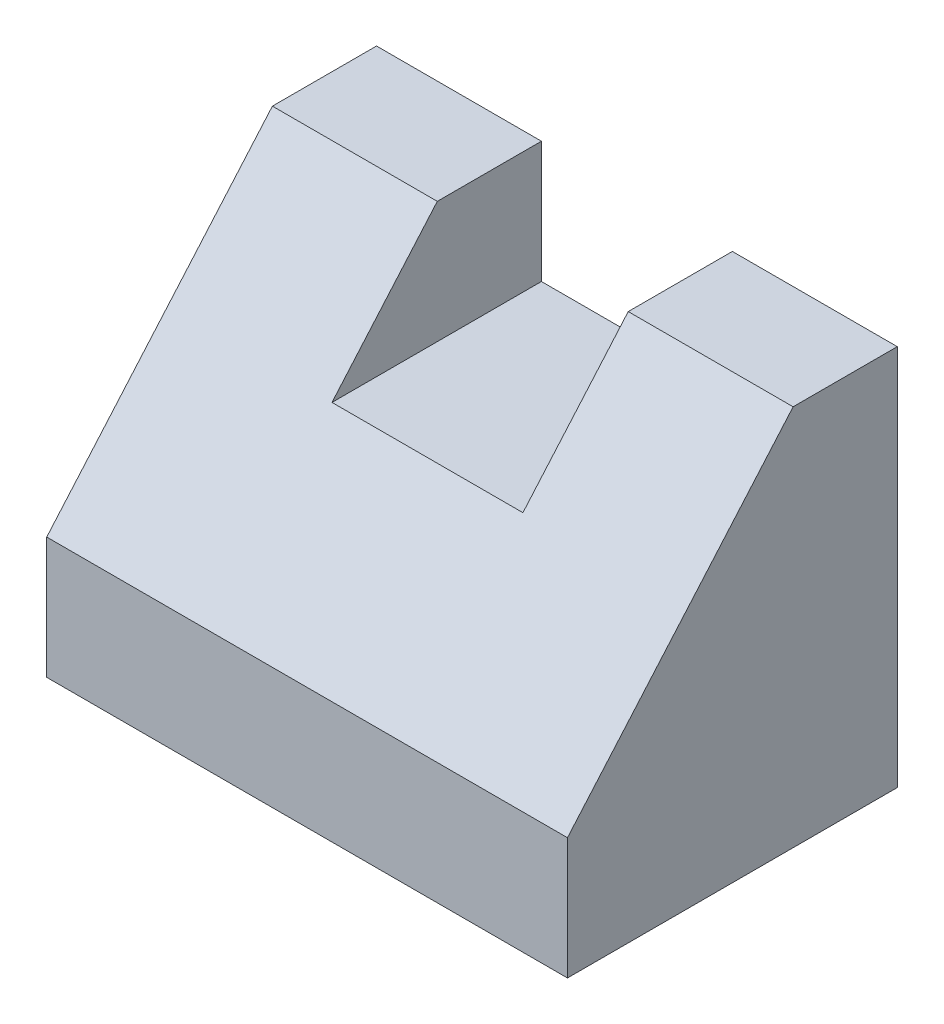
SolidWorks part; units mm, degrees
ref_plane "前视基准面" through (0, 0, 0) normal (0, 0, 1) x (1, 0, 0)
ref_plane "上视基准面" through (0, 0, 0) normal (0, 1, 0) x (1, 0, 0)
ref_plane "右视基准面" through (0, 0, 0) normal (1, 0, 0) x (0, 0, -1)
sketch "草图1" plane through (0, 0, 0) normal (1, 0, 0) x (0, 0, -1)
  line L0 (0, 0) -> (0, -22)
  line L1 (0, -22) -> (-19, -22)
  line L2 (-19, -22) -> (-19, -15)
  line L3 (-19, -15) -> (-6, 0)
  line L4 (-6, 0) -> (0, 0)
  dimension "D1" = 22
  dimension "D2" = 19
  dimension "D3" = 7
  dimension "D4" = 6
extrude "拉伸1" add sketch "草图1" along normal mid plane 30
sketch "草图2" plane through (0, 0, 0) normal (0, 0, -1) x (-1, 0, 0)
  line L0 (0, 0) -> (0, -15.5019) construction
  line L2 (-5.5, 2.2663) -> (5.5, 2.2663)
  line L3 (-5.5, 2.2663) -> (-5.5, -7)
  line L4 (-5.5, -7) -> (5.5, -7)
  line L5 (5.5, 2.2663) -> (5.5, -7)
extrude "切除-拉伸1" cut sketch "草图2" against normal blind 30
